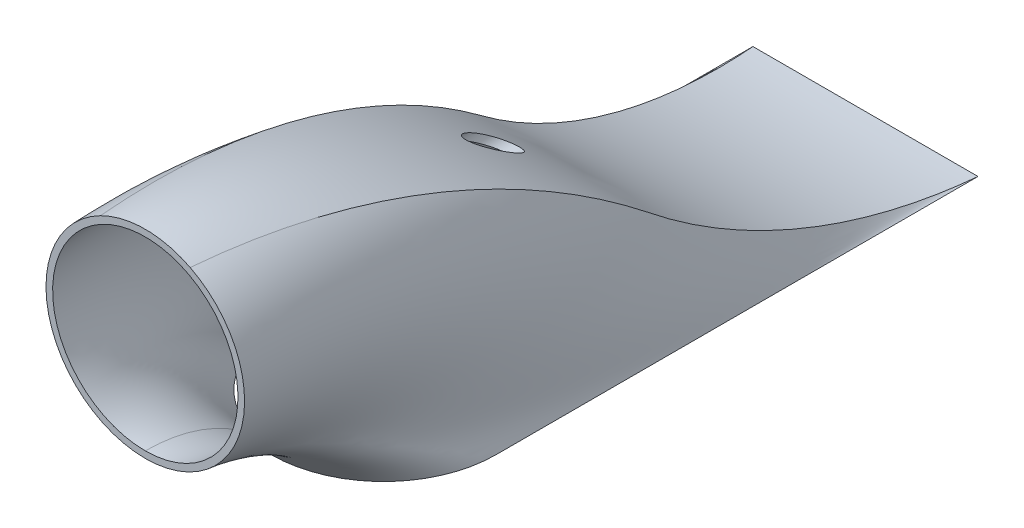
SolidWorks part; units mm, degrees
ref_plane "Спереди" through (0, 0, 0) normal (0, 0, 1) x (1, 0, 0)
ref_plane "Сверху" through (0, 0, 0) normal (0, 1, 0) x (1, 0, 0)
ref_plane "Справа" through (0, 0, 0) normal (1, 0, 0) x (0, 0, -1)
sketch "Эскиз1" plane through (0, 0, 0) normal (0, 0, 1) x (1, 0, 0)
  line L0 (0, 0) -> (0, 63.5947) construction
  circle A1 centre (0, 24) radius 15
  dimension "D2" = 30
  dimension "D3" = 24
sketch "Эскиз2" plane through (0, 0, 0) normal (0, 1, 0) x (1, 0, 0)
  line L0 (0, 0) -> (0, 111.3668) construction
  line L1 (0, 19) -> (0, 113.709) construction
  line L4 (-17, 36) -> (-17, 108.7978)
  line L5 (-17, 108.7978) -> (17, 108.7978)
  line L6 (17, 108.7978) -> (17, 36)
  arc A1 (-17, 36) -> (17, 36) centre (0, 36) ccw
  dimension "D1" = 72.7978
  dimension "D2" = 34
  dimension "D4" = 36
sketch "Эскиз3" plane through (0, 0, 0) normal (1, 0, 0) x (0, 0, -1)
  line L0 (0, 45.7558) -> (0, -60.0963) construction
  line L1 (0, 0) -> (0, 63.5947) construction
  line L2 (0, 0) -> (190.7772, 0) construction
  arc A1 (63.5294, 16.2271) -> (0, 39) centre (0, -61) ccw
  arc A2 (63.5294, 16.2271) -> (108.7978, 0) centre (108.7978, 71.2559) ccw
  dimension "D3" = 100
sketch "Эскиз4" plane through (0, 0, 0) normal (1, 0, 0) x (0, 0, -1)
  line L6 (0, 39) -> (0, 9)
  line L7 (0, 39) -> (0, 9) construction
  line L17 (0, 45.7558) -> (0, -60.0963) construction
  line L18 (36, 0) -> (19, 0)
  line L19 (36, 0) -> (19, 0) construction
  arc A0 (19, 0) -> (0, 9) centre (0, -15.5556) ccw
  dimension "D1" = 0
  dimension "D2" = 0
loft "По сечениям2" add profiles "Эскиз1", "Эскиз2"
sketch "Эскиз6" plane through (0, 0, 0) normal (0, 1, 0) x (1, 0, 0)
  line L0 (0, 0) -> (0, 112.2212) construction
  line L1 (-16, 98.7978) -> (-16, 36)
  line L2 (16, 36) -> (16, 98.7978)
  line L3 (16, 98.7978) -> (-16, 98.7978)
  line L4 (-17, 108.7978) -> (-17, 36) construction
  line L5 (17, 36) -> (17, 108.7978) construction
  line L6 (17, 108.7978) -> (-17, 108.7978) construction
  arc A0 (-16, 36) -> (16, 36) centre (0, 36) ccw
  dimension "D3" = 17
  dimension "D1" = 1
  dimension "D2" = 1
  dimension "D4" = 10
sketch "Эскиз7" plane through (0, 0, 0) normal (0, 0, 1) x (1, 0, 0)
  line L0 (0, 0) -> (0, 39.8472) construction
  circle A0 centre (0, 24) radius 14
  arc A1 (6.7818, 37.3793) -> (-6.7818, 37.3793) centre (0, 24) ccw construction
  dimension "D1" = 28
  dimension "D2" = 0
sketch "Эскиз8" plane through (0, 0, 0) normal (1, 0, 0) x (0, 0, -1)
  line L0 (0, 0) -> (0, 52.5251) construction
  line L1 (0, 0) -> (125.6312, 0) construction
  line L4 (0, 38) -> (0, 10)
  line L5 (0, 38) -> (0, 10) construction
  line L6 (0, 0) -> (0, -28.8914) construction
  line L7 (36, 0) -> (20, 0)
  line L8 (36, 0) -> (20, 0) construction
  line L11 (36, 0) -> (98.7978, 0)
  line L12 (36, 0) -> (98.7978, 0) construction
  arc A1 (66.3413, 12.4835) -> (0, 38) centre (0, -61) ccw
  arc A2 (66.3413, 12.4835) -> (98.7978, 0) centre (98.7978, 48.4343) ccw
  dimension "D4" = 198
  dimension "D1" = 0
  dimension "D2" = 0
  dimension "D3" = 0
sketch "Эскиз10" plane through (0, 0, 0) normal (1, 0, 0) x (0, 0, -1)
  line L0 (0, 0) -> (0, -38.926) construction
  line L3 (0, 38) -> (0, 10)
  line L4 (0, 38) -> (0, 10)
  line L6 (36, 0) -> (20, 0)
  line L7 (36, 0) -> (20, 0)
  arc A0 (20, 0) -> (0, 10) centre (0, -15) ccw
  dimension "D1" = 0
  dimension "D2" = 0
loft "Вырез-По сечениям1" cut profiles "Эскиз7", "Эскиз6"
sketch "Эскиз11" plane through (0, 0, 0) normal (0, 0, 1) x (1, 0, 0)
  line L0 (0, 0) -> (0, 40.0897) construction
  circle A0 centre (0, 24) radius 2.5
  arc A1 (0, 10) -> (6.6577, 36.3156) centre (0, 24) ccw construction
  dimension "D1" = 5
  dimension "D2" = 0
extrude "Вырез-Вытянуть1" cut sketch "Эскиз11" against normal through all
